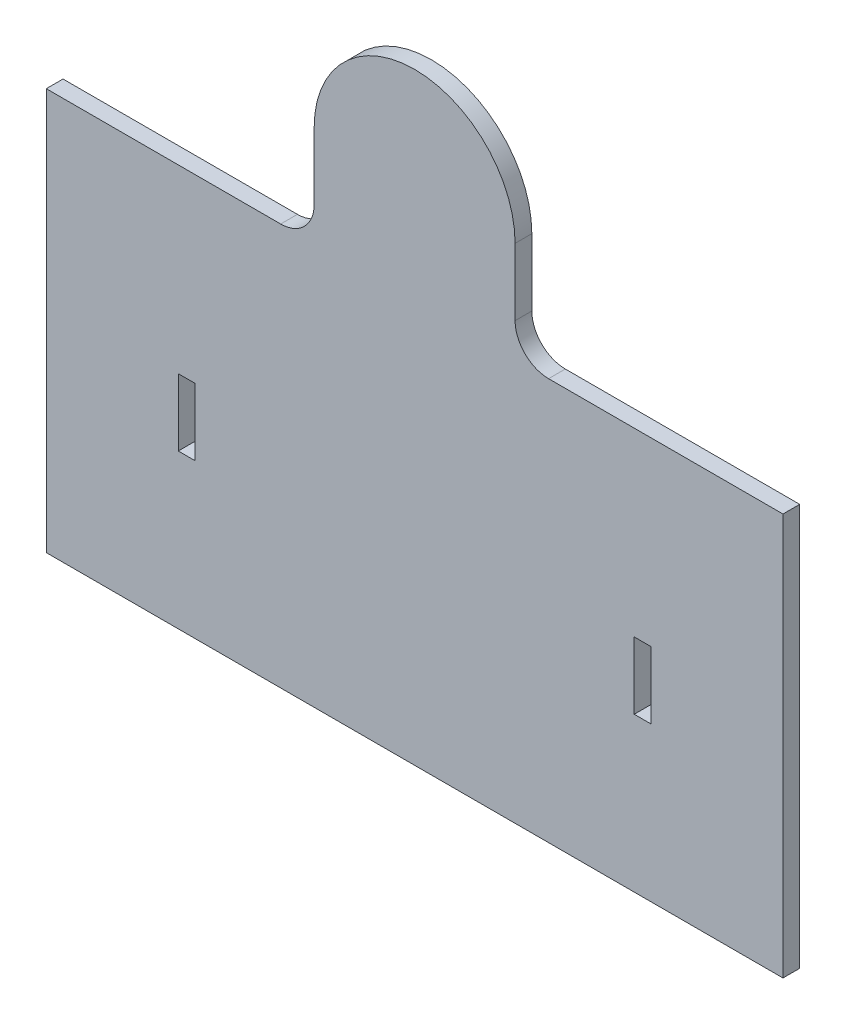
SolidWorks part; units mm, degrees
ref_plane "Front Plane" through (0, 0, 0) normal (0, 0, 1) x (1, 0, 0)
ref_plane "Top Plane" through (0, 0, 0) normal (0, 1, 0) x (1, 0, 0)
ref_plane "Right Plane" through (0, 0, 0) normal (1, 0, 0) x (0, 0, -1)
sketch "Sketch1" plane through (0, 0, 0) normal (0, 0, 1) x (1, 0, 0)
  line L1 (-52.79, 29.2445) -> (-87.79, 29.2445)
  line L2 (22.21, 29.2445) -> (22.21, -30.7555)
  line L3 (22.21, -30.7555) -> (-87.79, -30.7555)
  line L4 (-87.79, 29.2445) -> (-87.79, -30.7555)
  line L7 (2.5, 6.7445) -> (0, 6.7445) construction
  line L8 (2.5, -7.7555) -> (0, -7.7555) construction
  line L9 (0, 2.2445) -> (0, -7.7555) construction
  line L10 (2.5, 2.2445) -> (2.5, -7.7555) construction
  line L11 (2.5, 2.2445) -> (0, 2.2445) construction
  line L12 (-65.5833, -7.7555) -> (-65.5833, 2.2445)
  line L13 (-65.5833, 2.2445) -> (-68.0833, 2.2445)
  line L14 (-68.0833, 2.2445) -> (-68.0833, -7.7555)
  line L15 (-68.0833, -7.7555) -> (-65.5833, -7.7555)
  line L16 (-65.5833, -7.7555) -> (-65.5833, 2.2445)
  line L17 (-65.5833, 2.2445) -> (-68.0833, 2.2445)
  line L18 (-68.0833, 2.2445) -> (-68.0833, -7.7555)
  line L19 (-68.0833, -7.7555) -> (-65.5833, -7.7555)
  line L20 (2.5, -7.7555) -> (0, -7.7555)
  line L21 (0, 2.2445) -> (0, -7.7555)
  line L22 (2.5, 2.2445) -> (2.5, -7.7555)
  line L23 (2.5, 2.2445) -> (0, 2.2445)
  line L24 (-47.79, 44.2445) -> (-47.79, 34.2445)
  line L25 (-17.79, 44.2445) -> (-17.79, 34.2445)
  line L26 (-12.79, 29.2445) -> (22.21, 29.2445)
  arc A0 (-17.79, 44.2445) -> (-47.79, 44.2445) centre (-32.79, 44.2445) ccw
  arc A1 (-52.79, 29.2445) -> (-47.79, 34.2445) centre (-52.79, 34.2445) ccw
  arc A2 (-17.79, 34.2445) -> (-12.79, 29.2445) centre (-12.79, 34.2445) ccw
  point P24 (-17.79, 29.2445)
  dimension "D6" = 30
  dimension "D1" = 5
  dimension "D2" = 5
  dimension "D3" = 19.71
  dimension "D4" = 22.5
  dimension "D7" = 60
  dimension "D8" = 110
  dimension "D5" = 0
extrude "Boss-Extrude1" add sketch "Sketch1" along normal blind 2.5 contours L26 L2 L3 L4 L1 A1 L24 A0 L25 A2
sketch "Sketch2" plane through (0, 0, 2.5) normal (0, 0, 1) x (1, 0, 0)
  line L1 (-68.0833, 2.2445) -> (-65.5833, 2.2445)
  line L2 (-68.0833, 2.2445) -> (-68.0833, -7.7555)
  line L3 (-68.0833, -7.7555) -> (-65.5833, -7.7555)
  line L4 (-65.5833, 2.2445) -> (-65.5833, -7.7555)
  line L5 (0, 2.2445) -> (2.5, 2.2445)
  line L6 (0, 2.2445) -> (0, -7.7555)
  line L7 (0, -7.7555) -> (2.5, -7.7555)
  line L8 (2.5, 2.2445) -> (2.5, -7.7555)
extrude "Cut-Extrude1" cut sketch "Sketch2" against normal blind 2.5
